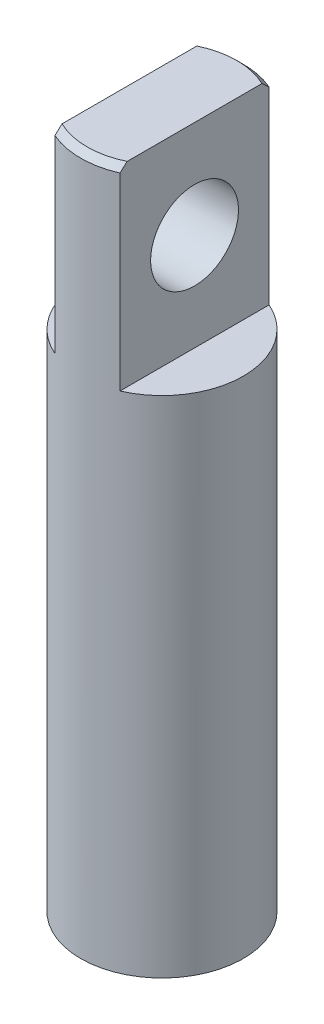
SolidWorks part; units mm, degrees
ref_plane "Front Plane" through (0, 0, 0) normal (0, 0, 1) x (1, 0, 0)
ref_plane "Top Plane" through (0, 0, 0) normal (0, 1, 0) x (1, 0, 0)
ref_plane "Right Plane" through (0, 0, 0) normal (1, 0, 0) x (0, 0, -1)
sketch "Sketch1" plane through (0, 0, 0) normal (0, 1, 0) x (1, 0, 0)
  circle A0 centre (0, 0) radius 2.5
  dimension "D1" = 5
extrude "Boss-Extrude1" add sketch "Sketch1" along normal blind 15.5
sketch "Sketch3" plane through (0, 15.5, 0) normal (0, 1, 0) x (1, 0, 0)
  line L0 (0, 0) -> (0, 2.6699) construction
  line L1 (1, -2.2913) -> (1, 2.2913)
  line L2 (-1, -2.2913) -> (-1, 2.2913)
  line L3 (-1, 0) -> (-1, 2.6699) construction
  line L4 (1, 0) -> (1, 2.6699) construction
  arc A1 (-1, -2.2913) -> (1, -2.2913) centre (0, 0) ccw
  arc A2 (1, 2.2913) -> (-1, 2.2913) centre (0, 0) ccw
  dimension "D1" = 1
  dimension "D2" = 1
extrude "Boss-Extrude2" add sketch "Sketch3" along normal blind 6
sketch "Sketch4" plane through (-1, 0, 0) normal (-1, 0, 0) x (0, 0, 1)
  line L1 (-2.2913, 21.5) -> (2.2913, 21.5) construction
  line L4 (0, 21.5) -> (0, 15.5) construction
  circle A0 centre (0, 18.5) radius 1.35
  dimension "D1" = 2.7
  dimension "D3" = 3
extrude "Cut-Extrude2" cut sketch "Sketch4" against normal blind 2
chamfer "Chamfer1" distance 0.2 angle 45 2 edges at (0, 21.5, -2.5) (0, 21.5, 2.5)
